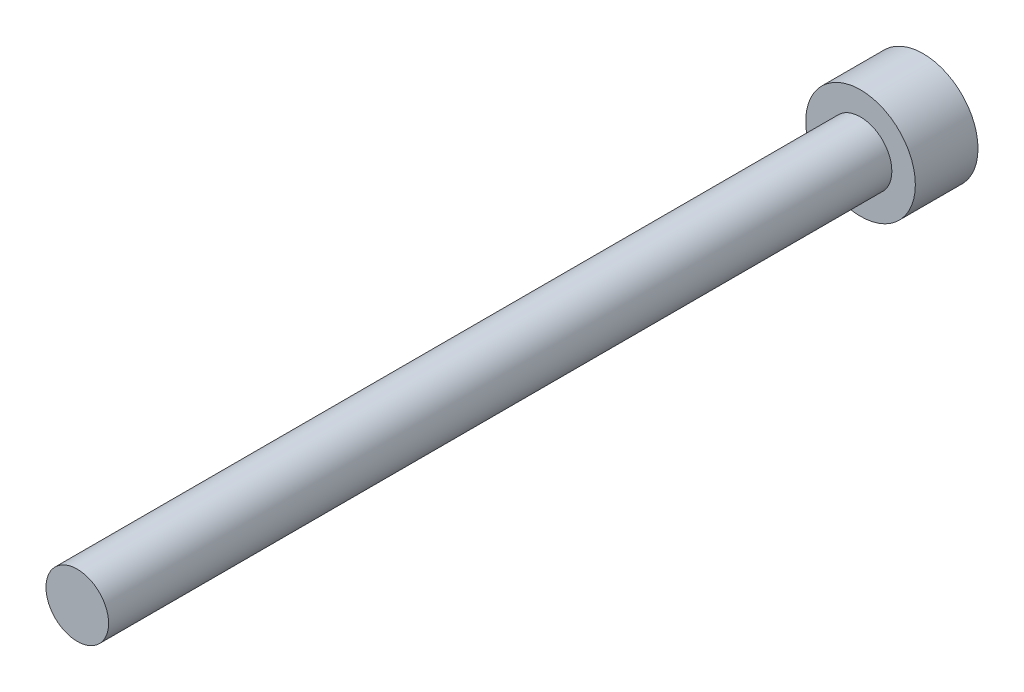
SolidWorks part; units mm, degrees
ref_plane "Front Plane" through (0, 0, 0) normal (0, 0, 1) x (1, 0, 0)
ref_plane "Top Plane" through (0, 0, 0) normal (0, 1, 0) x (1, 0, 0)
ref_plane "Right Plane" through (0, 0, 0) normal (1, 0, 0) x (0, 0, -1)
sketch "Sketch6" plane through (0, 0, 0) normal (1, 0, 0) x (0, 0, -1)
  line L0 (-50, 0) -> (22.525, 0) construction
  line L1 (3.85, 0) -> (-3.85, 0) construction
  line L2 (-50, 0) -> (-50, -2)
  line L3 (-50, -2) -> (0, -2)
  line L4 (0, 3.85) -> (0, -3.85) construction
  line L5 (0, -2) -> (0, -3.5)
  line L6 (0, -3.5) -> (4, -3.5)
  line L7 (4, -3.5) -> (4, 0)
  line L8 (4, 0) -> (-50, 0)
  dimension "L" = 50
  dimension "H" = 4
  dimension "A" = 7
  dimension "D" = 4
revolve "Revolve1" add sketch "Sketch6" angle 360 about L0
sketch "Sketch7" plane through (0, 0, -4) normal (0, 0, -1) x (-1, 0, 0)
  line L2 (-1.5, 0.866) -> (-1.5, -0.866)
  line L4 (-1.5, -0.866) -> (0, -1.7321)
  line L5 (0, -1.7321) -> (1.5, -0.866)
  line L6 (1.5, -0.866) -> (1.5, 0.866)
  line L7 (1.5, 0.866) -> (0, 1.7321)
  line L8 (0, 1.7321) -> (-1.5, 0.866)
  circle A0 centre (0, 0) radius 1.5 construction
  dimension "J" = 3
extrude "HEX" cut sketch "Sketch7" against normal blind 3
